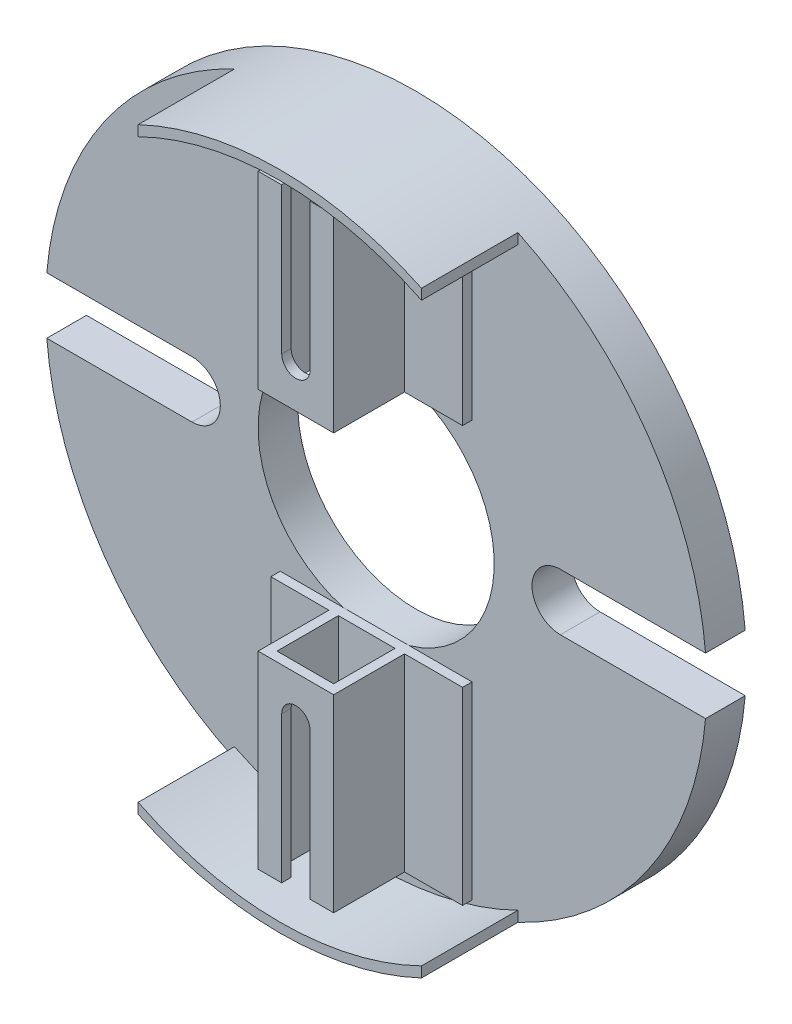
SolidWorks part; units mm, degrees
ref_plane "Plan de face" through (0, 0, 0) normal (0, 0, 1) x (1, 0, 0)
ref_plane "Plan de dessus" through (0, 0, 0) normal (0, 1, 0) x (1, 0, 0)
ref_plane "Plan de droite" through (0, 0, 0) normal (1, 0, 0) x (0, 0, -1)
sketch "Esquisse1" plane through (0, 0, 0) normal (0, 0, 1) x (1, 0, 0)
  line L0 (19.5, -33.1) -> (34.8712, -33.1)
  line L1 (-34.8712, -33.1) -> (-19.5, -33.1)
  line L2 (19.5, -39.1) -> (34.8712, -39.1)
  line L3 (-34.8712, -39.1) -> (-19.5, -39.1)
  arc A0 (-34.8712, -39.1) -> (34.8712, -39.1) centre (0, -36.1) ccw
  circle A1 centre (0, -36.1) radius 11.5 construction
  circle A3 centre (-31, -36.1) radius 2.75 construction
  arc A4 (34.8712, -33.1) -> (-34.8712, -33.1) centre (0, -36.1) ccw
  arc A5 (-19.5, -39.1) -> (-19.5, -33.1) centre (-19.5, -36.1) ccw
  arc A6 (19.5, -33.1) -> (19.5, -39.1) centre (19.5, -36.1) ccw
  circle A7 centre (0, -36.1) radius 12.5
  point P14 (0, -36.1)
  dimension "D1" = 70
  dimension "D3" = 3
  dimension "D4" = 39
  dimension "D2" = 3
  dimension "D5" = 19.5
  dimension "D6" = 25
extrude "Extrusion1" add sketch "Esquisse1" along normal blind 4.2
sketch "Esquisse2" plane through (0, 0, 4.2) normal (0, 0, 1) x (1, 0, 0)
  line L2 (-15, -4.4772) -> (-15, -5.5877)
  line L4 (15, -4.4772) -> (15, -5.5877)
  arc A0 (34.8712, -33.1) -> (-34.8712, -33.1) centre (0, -36.1) ccw construction
  arc A1 (15, -4.4772) -> (-15, -4.4772) centre (0, -36.1) ccw
  arc A2 (15, -5.5877) -> (-15, -5.5877) centre (0, -36.1) ccw
  arc A3 (34.8712, -33.1) -> (-34.8712, -33.1) centre (0, -36.1) ccw construction
  arc A4 (33.8749, -33.1857) -> (-33.8749, -33.1857) centre (0, -36.1) ccw construction
  dimension "D1" = 30
  dimension "D2" = 15
  dimension "D3" = 1
extrude "Extrusion2" add sketch "Esquisse2" along normal blind 10.2
ref_plane "Plan1" through (0, -36.1, 0) normal (0, 1, 0) x (-1, 0, 0)
ref_plane "Plan2" through (0, -24.1, 0) normal (0, 1, 0) x (-1, 0, 0)
sketch "Esquisse3" plane through (0, -24.1, 0) normal (0, 1, 0) x (-1, 0, 0)
  line L0 (-3, 5.2) -> (-3, 11.7)
  line L1 (-3, 11.7) -> (3, 11.7)
  line L2 (3, 11.7) -> (3, 5.2)
  line L3 (3, 4.2) -> (10.15, 4.2)
  line L4 (10.15, 4.2) -> (10.15, 5.2)
  line L5 (10.15, 5.2) -> (4, 5.2)
  line L6 (4, 5.2) -> (4, 12.7)
  line L7 (4, 12.7) -> (-4, 12.7)
  line L8 (-4, 12.7) -> (-4, 5.2)
  line L9 (3, 5.2) -> (-3, 5.2)
  line L10 (-10.15, 5.2) -> (-10.15, 4.2)
  line L11 (-10.15, 4.2) -> (3, 4.2)
  line L12 (-15, 4.2) -> (-34.8712, 4.2) construction
  line L13 (-4, 5.2) -> (-10.15, 5.2)
  dimension "D1" = 6
  dimension "D2" = 8
  dimension "D3" = 1
  dimension "D4" = 1
  dimension "D5" = 1
  dimension "D6" = 1
  dimension "D7" = 7.5
  dimension "D8" = 3
  dimension "D9" = 20.3
  dimension "D10" = 10.15
extrude "Extrusion3" add sketch "Esquisse3" along normal blind 20
sketch "Esquisse4" plane through (0, 0, 12.7) normal (0, 0, 1) x (1, 0, 0)
  line L0 (-4, -4.1) -> (4, -4.1) construction
  line L1 (-1.5, -4.1) -> (1.5, -4.1)
  line L2 (-1.5, -4.1) -> (-1.5, -19.6)
  line L3 (-3, -4.1) -> (3, -4.1) construction
  line L4 (1.5, -4.1) -> (1.5, -19.6)
  arc A0 (-1.5, -19.6) -> (1.5, -19.6) centre (0, -19.6) ccw
  dimension "D1" = 3
  dimension "D2" = 1.5
  dimension "D3" = 15.5
extrude "Enlèv. mat.-Extru.1" cut sketch "Esquisse4" against normal up to next
pattern_circular "Répétition circulaire1" count 2 every 180 about axis through (0, -36.1, 0) along (0, 0, 1) of "Extrusion3", "Extrusion2", "Enlèv. mat.-Extru.1"
ref_plane "Plan3" through (-18.05, -18.05, 0) normal (-0.7071, -0.7071, 0) x (0.7071, -0.7071, 0)
